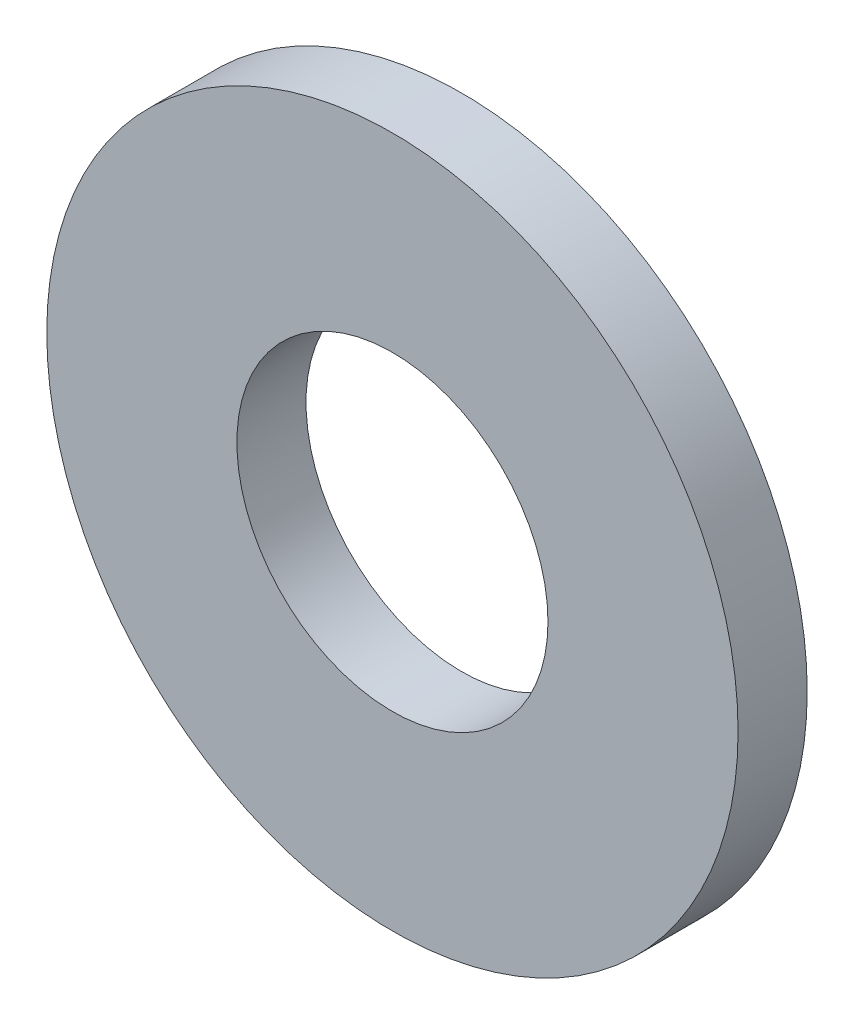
SolidWorks part; units mm, degrees
ref_plane "Plane1" through (0, 0, 0) normal (0, 0, 1) x (1, 0, 0)
ref_plane "Plane2" through (0, 0, 0) normal (0, 1, 0) x (1, 0, 0)
ref_plane "Plane3" through (0, 0, 0) normal (1, 0, 0) x (0, 0, -1)
sketch "Sketch1" plane through (0, 0, 0) normal (0, 0, 1) x (1, 0, 0)
  circle A0 centre (0, 0) radius 7.9375
  circle A1 centre (0, 0) radius 3.5719
  dimension "O.D." = 15.875
  dimension "I.D." = 7.1437
extrude "Washer" add sketch "Sketch1" along normal blind 1.5875
